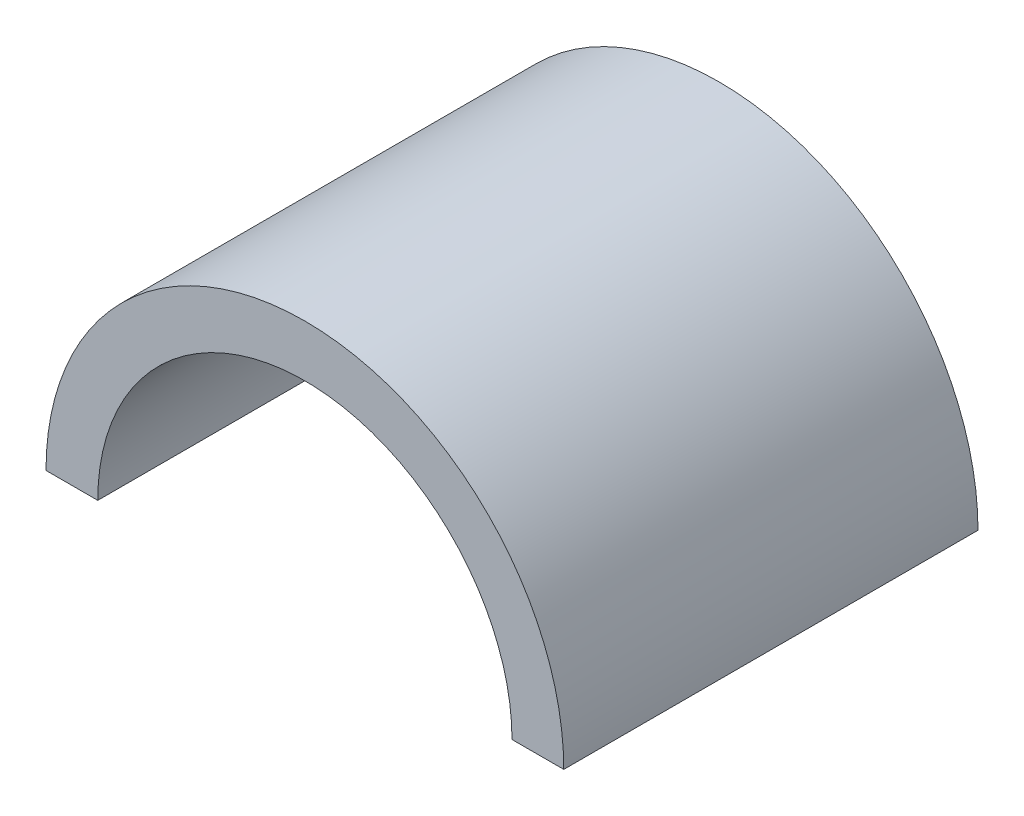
SolidWorks part; units mm, degrees
ref_plane "前视基准面" through (0, 0, 0) normal (0, 0, 1) x (1, 0, 0)
ref_plane "上视基准面" through (0, 0, 0) normal (0, 1, 0) x (1, 0, 0)
ref_plane "右视基准面" through (0, 0, 0) normal (1, 0, 0) x (0, 0, -1)
sketch "Sketch1" plane through (0, 0, 0) normal (0, 0, 1) x (1, 0, 0)
  line L0 (-75.0687, 0) -> (65.4342, 0) construction
  line L1 (50, 0) -> (40, 0)
  line L2 (-40, 0) -> (-50, 0)
  arc A0 (-50, 0) -> (50, 0) centre (0, 0) cw
  arc A1 (-40, 0) -> (40, 0) centre (0, 0) cw
  dimension "D1" = 40
  dimension "D2" = 50
extrude "Extrude1" add sketch "Sketch1" along normal mid plane 80
